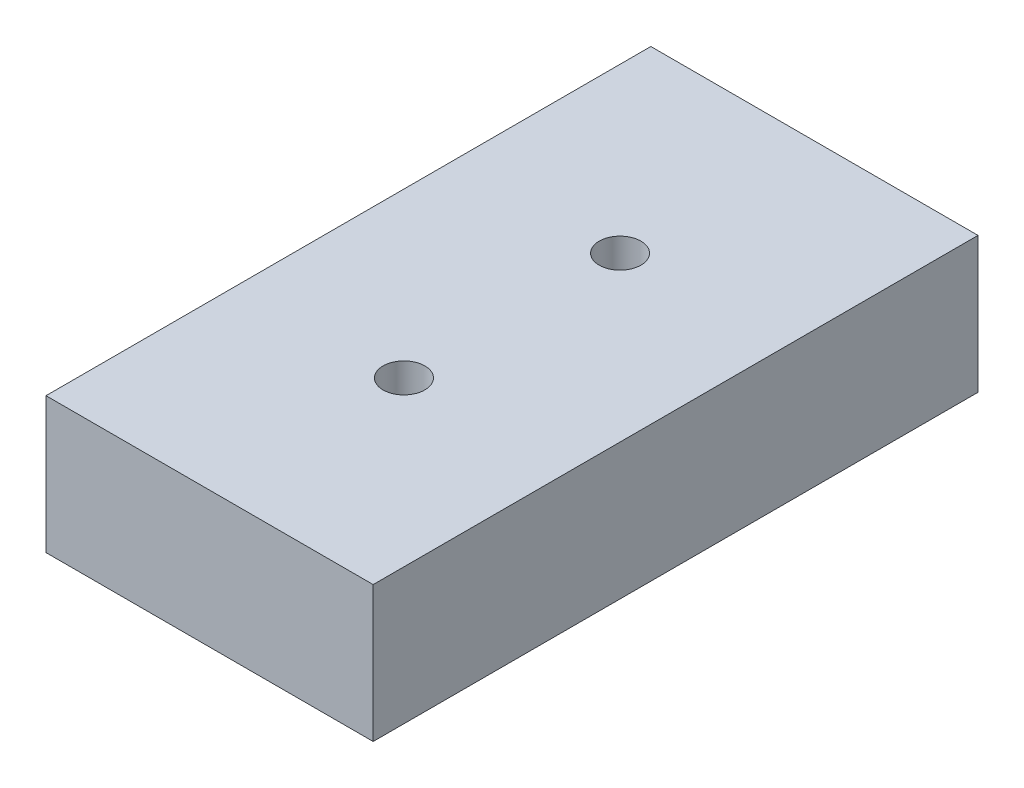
SolidWorks part; units mm, degrees
ref_plane "Front Plane" through (0, 0, 0) normal (0, 0, 1) x (1, 0, 0)
ref_plane "Top Plane" through (0, 0, 0) normal (0, 1, 0) x (1, 0, 0)
ref_plane "Right Plane" through (0, 0, 0) normal (1, 0, 0) x (0, 0, -1)
sketch "Sketch1" plane through (0, 0, 0) normal (0, 1, 0) x (1, 0, 0)
  line L1 (-16.85, 31.15) -> (16.85, 31.15)
  line L2 (-16.85, 31.15) -> (-16.85, -31.15)
  line L3 (-16.85, -31.15) -> (16.85, -31.15)
  line L4 (16.85, 31.15) -> (16.85, -31.15)
  line L5 (-16.85, 31.15) -> (16.85, -31.15) construction
  line L6 (-16.85, -31.15) -> (16.85, 31.15) construction
  circle A0 centre (0, 11.13) radius 2.15
  circle A1 centre (0, -11.13) radius 2.15
  point P0 (0, 0)
  dimension "D1" = 22.26
  dimension "D2" = 11.13
extrude "Boss-Extrude1" add sketch "Sketch1" along normal blind 14
